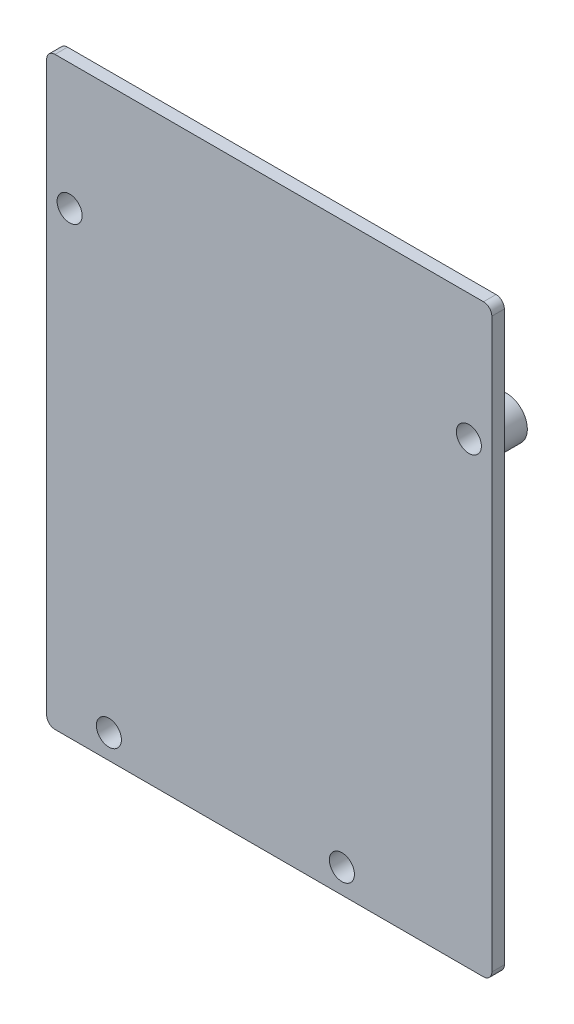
SolidWorks part; units mm, degrees
ref_plane "Plan de face" through (0, 0, 0) normal (0, 0, 1) x (1, 0, 0)
ref_plane "Plan de dessus" through (0, 0, 0) normal (0, 1, 0) x (1, 0, 0)
ref_plane "Plan de droite" through (0, 0, 0) normal (1, 0, 0) x (0, 0, -1)
sketch "Esquisse1" plane through (0, 0, 0) normal (0, 0, 1) x (1, 0, 0)
  line L1 (-26.65, 35) -> (26.65, 35)
  line L2 (-26.65, 35) -> (-26.65, -35)
  line L3 (-26.65, -35) -> (26.65, -35)
  line L4 (26.65, 35) -> (26.65, -35)
  dimension "D1" = 70
  dimension "D2" = 53.3
  dimension "D3" = 26.65
  dimension "D4" = 35
extrude "Boss.-Extru.1" add sketch "Esquisse1" along normal blind 1.5
fillet "Congé1" radius 1 4 edges at (-26.65, -35, 0.75) (26.65, -35, 0.75) (26.65, 35, 0.75) (-26.65, 35, 0.75)
sketch "Esquisse2" plane through (0, 0, 0) normal (0, 0, -1) x (-1, 0, 0)
  line L0 (-25.65, 35) -> (25.65, 35) construction
  line L1 (-26.65, -34) -> (-26.65, 34) construction
  line L2 (26.65, 34) -> (26.65, -34) construction
  line L3 (25.65, -35) -> (-25.65, -35) construction
  circle A0 centre (-23.9, 19.9) radius 2.5
  circle A1 centre (23.9, 19.9) radius 2.5
  circle A2 centre (-8.7, -32.1) radius 2.5
  circle A3 centre (19.2, -32.1) radius 2.5
  dimension "D1" = 15.1
  dimension "D2" = 5
  dimension "D3" = 2.75
  dimension "D4" = 5
  dimension "D5" = 2.75
  dimension "D6" = 5
  dimension "D9" = 5
  dimension "D10" = 27.9
  dimension "D7" = 2.9
  dimension "D8" = 17.95
extrude "Boss.-Extru.2" add sketch "Esquisse2" along normal blind 3
sketch "Esquisse3" plane through (0, 0, -3) normal (0, 0, -1) x (-1, 0, 0)
  circle A0 centre (-23.9, 19.9) radius 1.5
  circle A1 centre (-23.9, 19.9) radius 2.5 construction
  dimension "D1" = 3
extrude "Enlèv. mat.-Extru.1" cut sketch "Esquisse3" against normal blind 6
sketch "Esquisse4" plane through (0, 0, -3) normal (0, 0, -1) x (-1, 0, 0)
  circle A0 centre (23.9, 19.9) radius 1.5
  circle A1 centre (23.9, 19.9) radius 2.5 construction
  dimension "D1" = 3
extrude "Enlèv. mat.-Extru.2" cut sketch "Esquisse4" against normal blind 6
sketch "Esquisse5" plane through (0, 0, -3) normal (0, 0, -1) x (-1, 0, 0)
  circle A0 centre (-8.7, -32.1) radius 1.5
  circle A1 centre (-8.7, -32.1) radius 2.5 construction
  dimension "D1" = 3
extrude "Enlèv. mat.-Extru.3" cut sketch "Esquisse5" against normal blind 6
sketch "Esquisse6" plane through (0, 0, -3) normal (0, 0, -1) x (-1, 0, 0)
  circle A0 centre (19.2, -32.1) radius 1.5
  circle A2 centre (19.2, -32.1) radius 2.5 construction
  dimension "D1" = 3
extrude "Enlèv. mat.-Extru.4" cut sketch "Esquisse6" against normal blind 6
